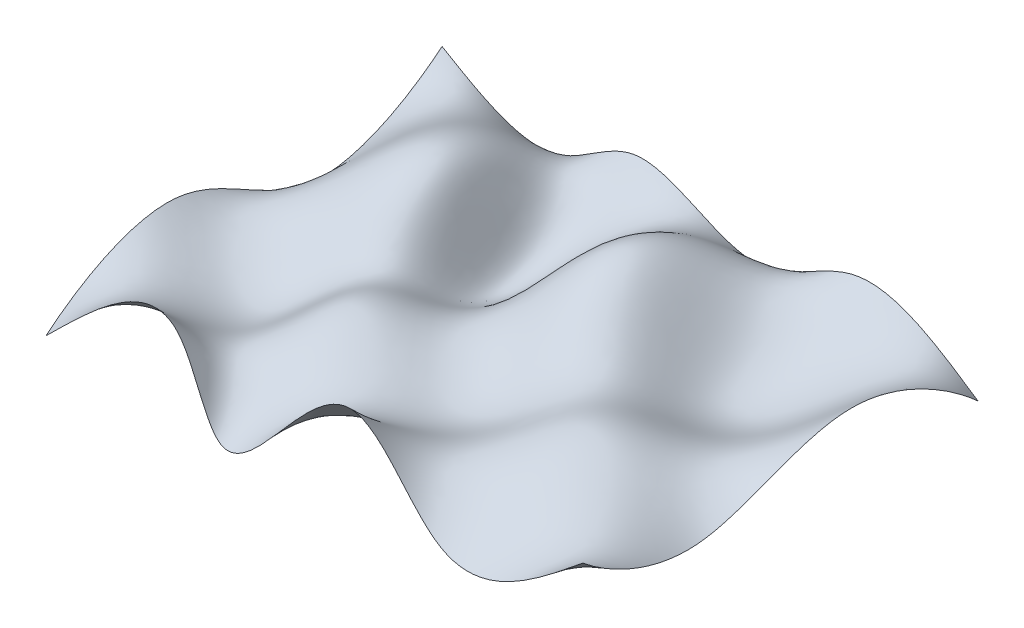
SolidWorks part; units mm, degrees
ref_plane "Front XY" through (0, 0, 0) normal (0, 0, 1) x (1, 0, 0)
ref_plane "Top XZ" through (0, 0, 0) normal (0, 1, 0) x (1, 0, 0)
ref_plane "Right YZ" through (0, 0, 0) normal (1, 0, 0) x (0, 0, -1)
sketch "Sketch1" plane through (0, 0, 0) normal (0, 0, 1) x (1, 0, 0)
  spline S0 degree 3 poles (-58.4441, 0) (-43.2719, 15.0018) (-19.1692, 38.8339) (-6.1618, -25.0033) (30.1027, 50.0515) (59.5196, -12.4385) (85.9505, 9.1063) (100.8311, 21.236) knots 0 0 0 0 0.222562 0.353564 0.592215 0.770417 1 1 1 1
ref_plane "Plane1" through (0, 0, -39.58) normal (0, 0, 1) x (1, 0, 0)
ref_plane "Plane2" through (0, 0, -79.16) normal (0, 0, 1) x (1, 0, 0)
ref_plane "Plane3" through (0, 0, -118.7399) normal (0, 0, 1) x (1, 0, 0)
sketch "Sketch2" plane through (0, 0, -39.58) normal (0, 0, 1) x (1, 0, 0)
  spline S0 degree 3 poles (-59.3493, 15.1904) (-48.266, 7.284) (-29.4453, -6.1419) (-4.602, 25.776) (28.1854, -6.1206) (62.0984, 28.7592) (84.6097, 11.9249) (95.4701, 3.8034) knots 0 0 0 0 0.205162 0.34839 0.554607 0.785123 1 1 1 1
sketch "Sketch3" plane through (0, 0, -79.16) normal (0, 0, 1) x (1, 0, 0)
  spline S0 degree 3 poles (-58.4441, 0) (-43.2719, 15.0018) (-19.1692, 38.8339) (-6.1618, -25.0033) (30.1027, 50.0515) (59.5196, -12.4385) (85.9505, 9.1063) (100.8311, 21.236) knots 0 0 0 0 0.222562 0.353564 0.592215 0.770417 1 1 1 1
sketch "Sketch4" plane through (0, 0, -118.7399) normal (0, 0, 1) x (1, 0, 0)
  spline S0 degree 3 poles (-59.6912, 14.3544) (-47.8235, 7.3314) (-27.7727, -4.5342) (0.3091, 25.0017) (32.006, -5.2062) (64.7531, 26.013) (86.9336, 11.0742) (99.3031, 2.7432) knots 0 0 0 0 0.214133 0.361784 0.582106 0.766951 1 1 1 1
surface "Surface-Loft1"
sketch "Sketch5" plane through (0, 0, 0) normal (0, 1, 0) x (1, 0, 0)
  arc A0 (-59.6912, 118.7399) -> (85.6298, 11.0996) centre (-78.4855, -58.5497) cw
  arc A1 (-58.4441, 0) -> (85.6298, 11.0996) centre (20, -77.6159) cw
sketch3d "3DSketch1"
  spline S0 degree 3 poles (-304.9967, -1487.2541, -1248.0392) (197.1684, 363.0561, 189.5977) (74.7091, -72.8231, 8.2687) (120.7601, 98.1619, -127.1019) (33.2312, -347.4082, -307.6474) (387.6335, 1542.2378, 1124.0243) knots -1.468188 -1.468188 -1.468188 -1.468188 0.333024 0.666047 2.469229 2.469229 2.469229 2.469229 only from (100.8311, 21.236, 0) to (99.3031, 2.7432, -118.7399) construction
  spline S1 degree 3 poles (100.8311, 21.236, 0) (98.4484, 13.4882, -8.7956) (91.8807, -9.0661, -42.2084) (103.5764, 34.3596, -76.589) (100.4089, 10.8442, -109.9607) (99.3031, 2.7432, -118.7399) knots 0 0 0 0 0.333024 0.666047 1 1 1 1
sketch3d "3DSketch2"
  spline S0 degree 3 poles (180.1563, 1474.2498, -1348.5604) (48.033, -322.8625, 196.4575) (75.3384, 88.7531, 9.7797) (63.517, -68.5012, -129.1335) (117.3249, 332.9298, -315.848) (-133.4678, -1438.8771, 1236.5721) knots -1.509822 -1.509822 -1.509822 -1.509822 0.333024 0.666047 2.525241 2.525241 2.525241 2.525241 only from (69.3781, 2.2122, 0) to (72.8487, 16.5924, -118.7399) construction
  spline S1 degree 3 poles (69.3781, 2.2122, 0) (69.7106, 9.3551, -8.7956) (70.9151, 29.9124, -42.1982) (67.9854, -9.0595, -76.6247) (71.6067, 10.0145, -109.8839) (72.8487, 16.5924, -118.7399) knots 0 0 0 0 0.333024 0.666047 1 1 1 1
sketch3d "3DSketch3"
  spline S0 degree 3 poles (265.6134, -1044.023, -1678.2782) (1.2434, 230.7616, 218.009) (53.2993, -31.9828, 13.7952) (33.3613, 63.0557, -132.0785) (110.2058, -210.8364, -333.9436) (-270.4615, 1101.8504, 1525.81) knots -1.630567 -1.630567 -1.630567 -1.630567 0.333024 0.666047 2.616091 2.616091 2.616091 2.616091 only from (42.8162, 19.9527, 0) to (46.7755, 9.6703, -118.7399) construction
  spline S1 degree 3 poles (42.8162, 19.9527, 0) (43.4857, 16.0244, -8.7956) (45.6438, 4.5087, -42.2152) (40.9488, 26.8883, -76.5654) (45.2905, 14.0786, -110.0114) (46.7755, 9.6703, -118.7399) knots 0 0 0 0 0.333024 0.666047 1 1 1 1
sketch3d "3DSketch4"
  spline S0 degree 3 poles (296.8471, -856.788, -1777.3733) (-36.324, 185.6586, 223.8406) (28.2623, -25.6453, 15.0592) (4.1211, 49.0055, -133.9778) (94.9403, -157.4064, -341.7111) (-369.9557, 861.0674, 1647.623) knots -1.664888 -1.664888 -1.664888 -1.664888 0.333024 0.666047 2.668172 2.668172 2.668172 2.668172 only from (15.532, 15.2335, 0) to (19.8008, 8.6586, -118.7399) construction
  spline S1 degree 3 poles (15.532, 15.2335, 0) (16.3636, 12.0944, -8.7956) (18.9865, 3.0377, -42.2051) (13.4151, 20.2659, -76.6005) (18.1697, 11.6352, -109.9361) (19.8008, 8.6586, -118.7399) knots 0 0 0 0 0.333024 0.666047 1 1 1 1
sketch3d "3DSketch5"
  spline S0 degree 3 poles (-10.3125, 1424.6061, -1402.8585) (-6.1285, -308.7028, 200.161) (-9.0898, 80.9867, 10.4875) (-8.9143, -66.4171, -129.7423) (6.8117, 317.2419, -319.3391) (-73.0819, -1403.7549, 1289.8531) knots -1.530963 -1.530963 -1.530963 -1.530963 0.333024 0.666047 2.543695 2.543695 2.543695 2.543695 only from (-8.6261, -0.0177, 0) to (-7.0338, 13.7346, -118.7399) construction
  spline S1 degree 3 poles (-8.6261, -0.0177, 0) (-8.7717, 6.5782, -8.7956) (-9.0239, 25.603, -42.2008) (-8.9808, -10.5728, -76.6158) (-7.5293, 7.5021, -109.903) (-7.0338, 13.7346, -118.7399) knots 0 0 0 0 0.333024 0.666047 1 1 1 1
sketch3d "3DSketch6"
  spline S0 degree 3 poles (-465.1436, -1579.2626, -1112.3522) (78.2206, 407.483, 179.5773) (-57.2655, -86.8182, 6.3443) (-2.7236, 112.6955, -125.4916) (-134.8699, -379.1306, -298.1075) (398.8664, 1611.2181, 988.1997) knots -1.410061 -1.410061 -1.410061 -1.410061 0.333024 0.666047 2.419489 2.419489 2.419489 2.419489 only from (-27.0773, 23.3949, 0) to (-32.4093, 2.9479, -118.7399) construction
  spline S1 degree 3 poles (-27.0773, 23.3949, 0) (-29.6812, 13.9508, -8.7956) (-37.1829, -13.3562, -42.1983) (-22.9405, 38.7422, -76.6243) (-29.9815, 12.1242, -109.8848) (-32.4093, 2.9479, -118.7399) knots 0 0 0 0 0.333024 0.666047 1 1 1 1
sketch3d "3DSketch7"
  spline S0 degree 3 poles (-150.3615, 1440.7128, -1383.3613) (-38.8601, -313.8069, 198.8657) (-63.6521, 82.8221, 10.2157) (-54.0397, -67.8538, -129.3917) (-82.3734, 324.4925, -317.7836) (45.698, -1422.8795, 1267.2135) knots -1.523302 -1.523302 -1.523302 -1.523302 0.333024 0.666047 2.53382 2.53382 2.53382 2.53382 only from (-58.4441, 0, 0) to (-59.6912, 14.3544, -118.7399) construction
  spline S1 degree 3 poles (-58.4441, 0, 0) (-58.8464, 6.7513, -8.7956) (-60.043, 26.2488, -42.2018) (-57.6737, -10.8898, -76.6122) (-59.1748, 7.8821, -109.9107) (-59.6912, 14.3544, -118.7399) knots 0 0 0 0 0.333024 0.666047 1 1 1 1
sketch3d "3DSketch8"
  spline S0 degree 3 poles (35.8441, -1974.1163, 0) (284.8955, 548.0353, 0) (132.5537, -30.9875, 0) (59.2891, 3.7999, 0) (48.9144, 10.09, 0) (40.3127, 27.9278, 0) (28.6652, 26.0404, 0) (15.6578, 19.5833, 0) (1.6013, -5.3437, 0) (-6.3633, -2.127, 0) (-11.5172, 1.2795, 0) (-14.6739, 15.9518, 0) (-20.4297, 21.4952, 0) (-71.8341, 58.3825, 0) (-297.7164, -567.9002, 0) (309.6885, 1963.6362, 0) knots -1.107789 -1.107789 -1.107789 -1.107789 0.214877 0.229583 0.233049 0.407785 0.417894 0.445393 0.638216 0.646436 0.65161 0.777438 0.785867 0.794838 1.990554 1.990554 1.990554 1.990554 only from (100.8311, 21.236, 0) to (-58.4441, 0, 0) construction
  spline S1 degree 3 poles (100.8311, 21.236, 0) (86.9037, 9.8832, 0) (72.0231, -2.2465, 0) (59.2891, 3.7999, 0) (48.9144, 10.09, 0) (40.3127, 27.9278, 0) (28.6652, 26.0404, 0) (15.6578, 19.5833, 0) (1.6013, -5.3437, 0) (-6.3633, -2.127, 0) (-11.5172, 1.2795, 0) (-14.6739, 15.9518, 0) (-20.4297, 21.4952, 0) (-29.8605, 28.2626, 0) (-44.4581, 13.829, 0) (-58.4441, 0, 0) knots 0 0 0 0 0.214877 0.229583 0.233049 0.407785 0.417894 0.445393 0.638216 0.646436 0.65161 0.777438 0.785867 0.794838 1 1 1 1
sketch3d "3DSketch9"
  spline S0 degree 3 poles (-96.2896, 1989.1349, -15.1933) (382.4998, -234.6884, -18.1141) (188.6552, 10.8311, -17.8126) (60.5618, 14.0307, -17.8274) (50.5084, 14.2339, -17.8286) (41.064, 13.938, -17.8315) (29.576, 11.8489, -17.8296) (16.9412, 9.4501, -17.8268) (3.7016, 10.2371, -17.829) (-5.9426, 10.3694, -17.8275) (-12.3447, 10.4281, -17.8268) (-17.7299, 9.7638, -17.8288) (-24.2724, 8.9635, -17.8277) (-118.8266, -1.5226, -17.8112) (-435.4584, 214.4462, -18.022) (1190.379, -1545.9908, -16.2497) knots -2.214906 -2.214906 -2.214906 -2.214906 0.214877 0.229583 0.233049 0.407785 0.417894 0.445393 0.638216 0.646436 0.65161 0.777438 0.785867 0.794838 2.806051 2.806051 2.806051 2.806051 only from (97.1395, 9.0071, -17.8287) to (-59.0839, 10.6267, -17.8275) construction
  spline S1 degree 3 poles (97.1395, 9.0071, -17.8287) (85.3514, 11.2885, -17.8274) (72.7565, 13.7261, -17.826) (60.5618, 14.0307, -17.8274) (50.5084, 14.2339, -17.8286) (41.064, 13.938, -17.8315) (29.576, 11.8489, -17.8296) (16.9412, 9.4501, -17.8268) (3.7016, 10.2371, -17.829) (-5.9426, 10.3694, -17.8275) (-12.3447, 10.4281, -17.8268) (-17.7299, 9.7638, -17.8288) (-24.2724, 8.9635, -17.8277) (-34.6461, 7.8131, -17.8259) (-47.1264, 9.25, -17.8267) (-59.0839, 10.6267, -17.8275) knots 0 0 0 0 0.214877 0.229583 0.233049 0.407785 0.417894 0.445393 0.638216 0.646436 0.65161 0.777438 0.785867 0.794838 1 1 1 1
sketch3d "3DSketch10"
  spline S0 degree 3 poles (328.673, 1986.3556, -39.6232) (211.0224, -437.0507, -39.6185) (140.0942, 32.7152, -39.6193) (61.0459, 18.4366, -39.6193) (51.1329, 16.0316, -39.6193) (41.3252, 8.0074, -39.6192) (29.9061, 5.8009, -39.6192) (17.4324, 5.0896, -39.6193) (4.5432, 16.8892, -39.6192) (-5.8113, 15.7291, -39.6193) (-12.7413, 14.3725, -39.6193) (-19.0677, 7.1349, -39.6193) (-25.9358, 3.6038, -39.6193) (-93.0891, -24.8832, -39.6193) (-210.36, 472.0986, -39.6186) (-43.3466, -1981.8453, -39.6224) knots -1.307324 -1.307324 -1.307324 -1.307324 0.214877 0.229583 0.233049 0.407785 0.417894 0.445393 0.638216 0.646436 0.65161 0.777438 0.785867 0.794838 2.166377 2.166377 2.166377 2.166377 only from (95.4709, 3.8079, -39.6193) to (-59.3491, 15.1867, -39.6193) construction
  spline S1 degree 3 poles (95.4709, 3.8079, -39.6193) (84.6098, 11.9246, -39.6193) (73.0054, 20.5969, -39.6193) (61.0459, 18.4366, -39.6193) (51.1329, 16.0316, -39.6193) (41.3252, 8.0074, -39.6192) (29.9061, 5.8009, -39.6192) (17.4324, 5.0896, -39.6193) (4.5432, 16.8892, -39.6192) (-5.8113, 15.7291, -39.6193) (-12.7413, 14.3725, -39.6193) (-19.0677, 7.1349, -39.6193) (-25.9358, 3.6038, -39.6193) (-36.6964, -0.961, -39.6193) (-48.2651, 7.2856, -39.6193) (-59.3491, 15.1867, -39.6193) knots 0 0 0 0 0.214877 0.229583 0.233049 0.407785 0.417894 0.445393 0.638216 0.646436 0.65161 0.777438 0.785867 0.794838 1 1 1 1
sketch3d "3DSketch11"
  spline S0 degree 3 poles (-170.734, -1961.1276, -67.0723) (366.4981, 272.7222, -58.4196) (170.2053, -5.8797, -59.5024) (59.9572, 11.2209, -59.4395) (49.8241, 13.1477, -59.4335) (40.6091, 18.1553, -59.4188) (29.0782, 16.0003, -59.4283) (16.3438, 12.2467, -59.4423) (2.874, 5.7274, -59.4315) (-6.2569, 6.85, -59.4392) (-12.2778, 7.9334, -59.4427) (-16.9771, 11.6069, -59.4325) (-23.2512, 12.5528, -59.4381) (-104.8708, 20.7375, -59.5116) (-426.9575, -253.4362, -58.6811) (1097.1237, 1635.9456, -64.7753) knots -1.850529 -1.850529 -1.850529 -1.850529 0.214877 0.229583 0.233049 0.407785 0.417894 0.445393 0.638216 0.646436 0.65161 0.777438 0.785867 0.794838 2.587033 2.587033 2.587033 2.587033 only from (97.8397, 12.6332, -59.4329) to (-58.867, 7.6425, -59.4392) construction
  spline S1 degree 3 poles (97.8397, 12.6332, -59.4329) (85.4868, 11.0257, -59.4395) (72.2885, 9.3082, -59.4465) (59.9572, 11.2209, -59.4395) (49.8241, 13.1477, -59.4335) (40.6091, 18.1553, -59.4188) (29.0782, 16.0003, -59.4283) (16.3438, 12.2467, -59.4423) (2.874, 5.7274, -59.4315) (-6.2569, 6.85, -59.4392) (-12.2778, 7.9334, -59.4427) (-16.9771, 11.6069, -59.4325) (-23.2512, 12.5528, -59.4381) (-33.2896, 13.5594, -59.4471) (-46.3519, 10.5377, -59.4431) (-58.867, 7.6425, -59.4392) knots 0 0 0 0 0.214877 0.229583 0.233049 0.407785 0.417894 0.445393 0.638216 0.646436 0.65161 0.777438 0.785867 0.794838 1 1 1 1
sketch3d "3DSketch12"
  spline S0 degree 3 poles (35.8441, -1974.1893, -79.2197) (284.8957, 548.25, -79.243) (132.5435, -31.0151, -79.2378) (59.2907, 3.7912, -79.2383) (48.9157, 10.0859, -79.2384) (40.3147, 27.9358, -79.2386) (28.6671, 26.0497, -79.2385) (15.6593, 19.5917, -79.2383) (1.6021, -5.3544, -79.2384) (-6.3615, -2.1367, -79.2383) (-11.5148, 1.2715, -79.2383) (-14.6704, 15.9556, -79.2384) (-20.4261, 21.5042, -79.2383) (-71.8193, 58.4212, -79.2378) (-297.6709, -568.1464, -79.242) (309.4483, 1963.757, -79.2233) knots -1.107511 -1.107511 -1.107511 -1.107511 0.214877 0.229583 0.233049 0.407785 0.417894 0.445393 0.638216 0.646436 0.65161 0.777438 0.785867 0.794838 1.990291 1.990291 1.990291 1.990291 only from (100.8375, 21.2435, -79.2384) to (-58.444, -0.0083, -79.2383) construction
  spline S1 degree 3 poles (100.8375, 21.2435, -79.2384) (86.9081, 9.8807, -79.2383) (72.0253, -2.2597, -79.2382) (59.2907, 3.7912, -79.2383) (48.9157, 10.0859, -79.2384) (40.3147, 27.9358, -79.2386) (28.6671, 26.0497, -79.2385) (15.6593, 19.5917, -79.2383) (1.6021, -5.3544, -79.2384) (-6.3615, -2.1367, -79.2383) (-11.5148, 1.2715, -79.2383) (-14.6704, 15.9556, -79.2384) (-20.4261, 21.5042, -79.2383) (-29.8569, 28.2786, -79.2382) (-44.4563, 13.8325, -79.2383) (-58.444, -0.0083, -79.2383) knots 0 0 0 0 0.214877 0.229583 0.233049 0.407785 0.417894 0.445393 0.638216 0.646436 0.65161 0.777438 0.785867 0.794838 1 1 1 1
sketch3d "3DSketch13"
  spline S0 degree 3 poles (-24.9113, -1975.7048, -90.0868) (313.0668, 416.7545, -103.0882) (146.0314, -18.1252, -100.7748) (60.9258, 7.5509, -100.9563) (50.6292, 11.3716, -100.979) (41.7275, 21.0781, -101.0351) (30.135, 19.6724, -100.9989) (17.252, 15.8048, -100.9455) (3.5213, 1.4274, -100.9868) (-5.2972, 2.8556, -100.9573) (-11.0849, 4.5522, -100.9442) (-15.398, 13.0243, -100.9831) (-21.6819, 16.2234, -100.9615) (-85.3772, 41.0344, -100.7448) (-320.8037, -438.9536, -102.5853) (420.2895, 1942.9099, -92.7673) knots -1.342385 -1.342385 -1.342385 -1.342385 0.214877 0.229583 0.233049 0.407785 0.417894 0.445393 0.638216 0.646436 0.65161 0.777438 0.785867 0.794838 2.177342 2.177342 2.177342 2.177342 only from (100.916, 15.5247, -100.9813) to (-58.8675, 4.1978, -100.9575) construction
  spline S1 degree 3 poles (100.916, 15.5247, -100.9813) (87.6689, 9.8335, -100.9562) (73.5152, 3.7527, -100.9295) (60.9258, 7.5509, -100.9563) (50.6292, 11.3716, -100.979) (41.7275, 21.0781, -101.0351) (30.135, 19.6724, -100.9989) (17.252, 15.8048, -100.9455) (3.5213, 1.4274, -100.9868) (-5.2972, 2.8556, -100.9573) (-11.0849, 4.5522, -100.9442) (-15.398, 13.0243, -100.9831) (-21.6819, 16.2234, -100.9615) (-31.8084, 20.1679, -100.9271) (-45.6275, 12.012, -100.9426) (-58.8675, 4.1978, -100.9575) knots 0 0 0 0 0.214877 0.229583 0.233049 0.407785 0.417894 0.445393 0.638216 0.646436 0.65161 0.777438 0.785867 0.794838 1 1 1 1
sketch3d "3DSketch14"
  spline S0 degree 3 poles (269.5655, 1991.2241, -118.7399) (238.167, -425.8395, -118.7399) (146.0951, 28.2595, -118.7399) (63.5516, 16.9681, -118.7399) (53.4998, 14.8915, -118.7399) (43.8295, 6.0656, -118.7399) (32.3821, 5.1623, -118.7399) (19.8308, 6.397, -118.7399) (6.8822, 17.0855, -118.7399) (-3.7767, 14.8567, -118.7399) (-10.9314, 12.8716, -118.7399) (-17.7191, 6.5096, -118.7399) (-25.0244, 3.8465, -118.7399) (-100.7761, -17.6549, -118.7399) (-217.0041, 436.9227, -118.7399) (-85.7922, -1981.8374, -118.7399) knots -1.348787 -1.348787 -1.348787 -1.348787 0.214877 0.229583 0.233049 0.407785 0.417894 0.445393 0.638216 0.646436 0.65161 0.777438 0.785867 0.794838 2.252637 2.252637 2.252637 2.252637 only from (99.3031, 2.7432, -118.7399) to (-59.6912, 14.3544, -118.7399) construction
  spline S1 degree 3 poles (99.3031, 2.7432, -118.7399) (87.8981, 10.4246, -118.7399) (75.7126, 18.6317, -118.7399) (63.5516, 16.9681, -118.7399) (53.4998, 14.8915, -118.7399) (43.8295, 6.0656, -118.7399) (32.3821, 5.1623, -118.7399) (19.8308, 6.397, -118.7399) (6.8822, 17.0855, -118.7399) (-3.7767, 14.8567, -118.7399) (-10.9314, 12.8716, -118.7399) (-17.7191, 6.5096, -118.7399) (-25.0244, 3.8465, -118.7399) (-36.453, 0.6026, -118.7399) (-48.3207, 7.6256, -118.7399) (-59.6912, 14.3544, -118.7399) knots 0 0 0 0 0.214877 0.229583 0.233049 0.407785 0.417894 0.445393 0.638216 0.646436 0.65161 0.777438 0.785867 0.794838 1 1 1 1
